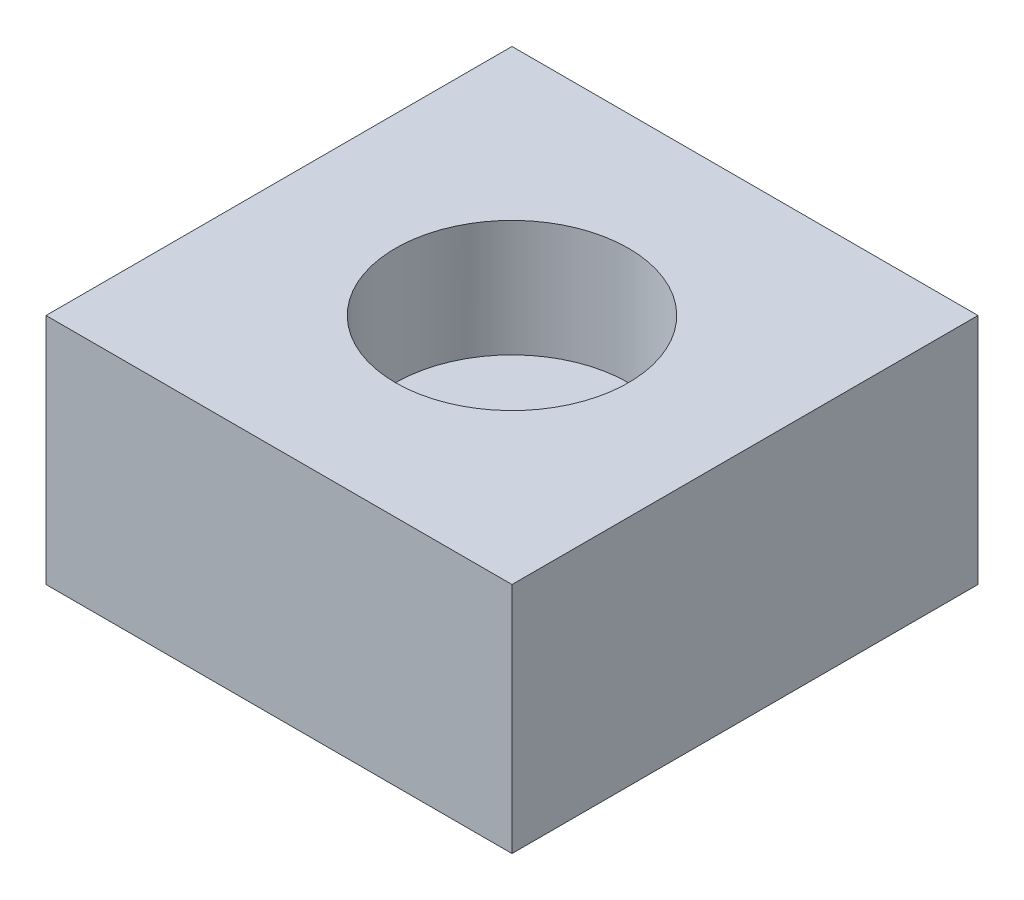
SolidWorks part; units mm, degrees
ref_plane "Front Plane" through (0, 0, 0) normal (0, 0, 1) x (1, 0, 0)
ref_plane "Top Plane" through (0, 0, 0) normal (0, 1, 0) x (1, 0, 0)
ref_plane "Right Plane" through (0, 0, 0) normal (1, 0, 0) x (0, 0, -1)
sketch "Sketch1" plane through (0, 0, 0) normal (0, 1, 0) x (1, 0, 0)
  line L1 (-1000, 1000) -> (1000, 1000)
  line L2 (-1000, 1000) -> (-1000, -1000)
  line L3 (-1000, -1000) -> (1000, -1000)
  line L4 (1000, 1000) -> (1000, -1000)
  line L5 (-1000, 1000) -> (1000, -1000) construction
  line L6 (-1000, -1000) -> (1000, 1000) construction
  circle A0 centre (0, 0) radius 500
  point P0 (0, 0)
  dimension "D3" = 1000
  dimension "D1" = 2000
  dimension "D2" = 2000
extrude "Boss-Extrude1" add sketch "Sketch1" along normal blind 1000
sketch "Sketch2" plane through (0, 0, 0) normal (0, -1, 0) x (1, 0, 0)
  circle A0 centre (0, 0) radius 500 construction
  circle A1 centre (0, 0) radius 500
extrude "Boss-Extrude2" add sketch "Sketch2" against normal blind 500
